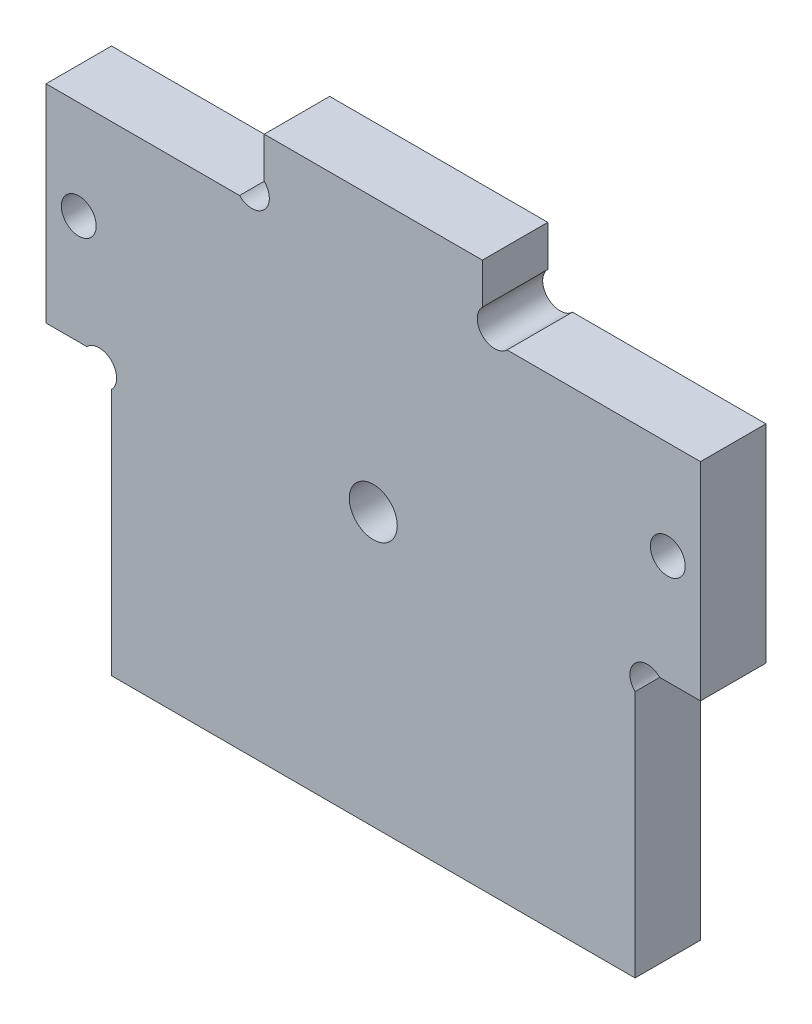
SolidWorks part; units mm, degrees
ref_plane "Plan de face" through (0, 0, 0) normal (0, 0, 1) x (1, 0, 0)
ref_plane "Plan de dessus" through (0, 0, 0) normal (0, 1, 0) x (1, 0, 0)
ref_plane "Plan de droite" through (0, 0, 0) normal (1, 0, 0) x (0, 0, -1)
sketch "Esquisse1" plane through (0, 0, 0) normal (0, 0, 1) x (1, 0, 0)
  line L0 (0, -5.3425) -> (0, 69.7724) construction
  line L1 (-53.7752, 0) -> (69.3659, 0) construction
  line L2 (-53.7752, 50) -> (69.3659, 50) construction
  line L3 (30, -5.3425) -> (30, 77.9943) construction
  line L4 (-30, -5.3425) -> (-30, 79.3023) construction
  line L5 (59.6492, 44) -> (-10.6104, 44) construction
  line L6 (10, 62.1112) -> (10, 42.1171) construction
  line L7 (24, 62.1112) -> (24, -5.3425) construction
  line L8 (59.6492, 25) -> (-6.3004, 25) construction
  line L9 (27, 39.1273) -> (27, 33.0146) construction
  line L10 (59.6492, 35) -> (41.15, 35) construction
  line L11 (10, 44) -> (22.0233, 56.0233) construction
  line L12 (24, 25) -> (33.2711, 15.7289) construction
  line L13 (10, 46.2627) -> (10, 50)
  line L14 (12.2627, 44) -> (30, 44)
  line L15 (30, 44) -> (30, 25)
  line L16 (30, 25) -> (26.2627, 25)
  line L17 (24, 22.7373) -> (24, 0)
  line L18 (-24, 22.7373) -> (-24, 0)
  line L19 (-30, 25) -> (-26.2627, 25)
  line L20 (-30, 44) -> (-30, 25)
  line L21 (-12.2627, 44) -> (-30, 44)
  line L22 (-10, 46.2627) -> (-10, 50)
  line L23 (-10, 50) -> (10, 50)
  line L24 (-24, 0) -> (24, 0)
  circle A0 centre (27, 35) radius 1.6
  arc A1 (10, 46.2627) -> (12.2627, 44) centre (11.1314, 45.1314) ccw
  arc A2 (26.2627, 25) -> (24, 22.7373) centre (25.1314, 23.8686) ccw
  arc A3 (-26.2627, 25) -> (-24, 22.7373) centre (-25.1314, 23.8686) cw
  arc A4 (-10, 46.2627) -> (-12.2627, 44) centre (-11.1314, 45.1314) cw
  circle A5 centre (-27, 35) radius 1.6
  circle A6 centre (0, 25) radius 2.2
  dimension "D1" = 50
  dimension "D2" = 60
  dimension "D3" = 30
  dimension "D4" = 6
  dimension "D5" = 25
  dimension "D6" = 6
  dimension "D7" = 10
  dimension "D8" = 10
  dimension "D9" = 3
  dimension "D10" = 45
  dimension "D11" = 45
extrude "Boss.-Extru.1" add sketch "Esquisse1" along normal blind 6
